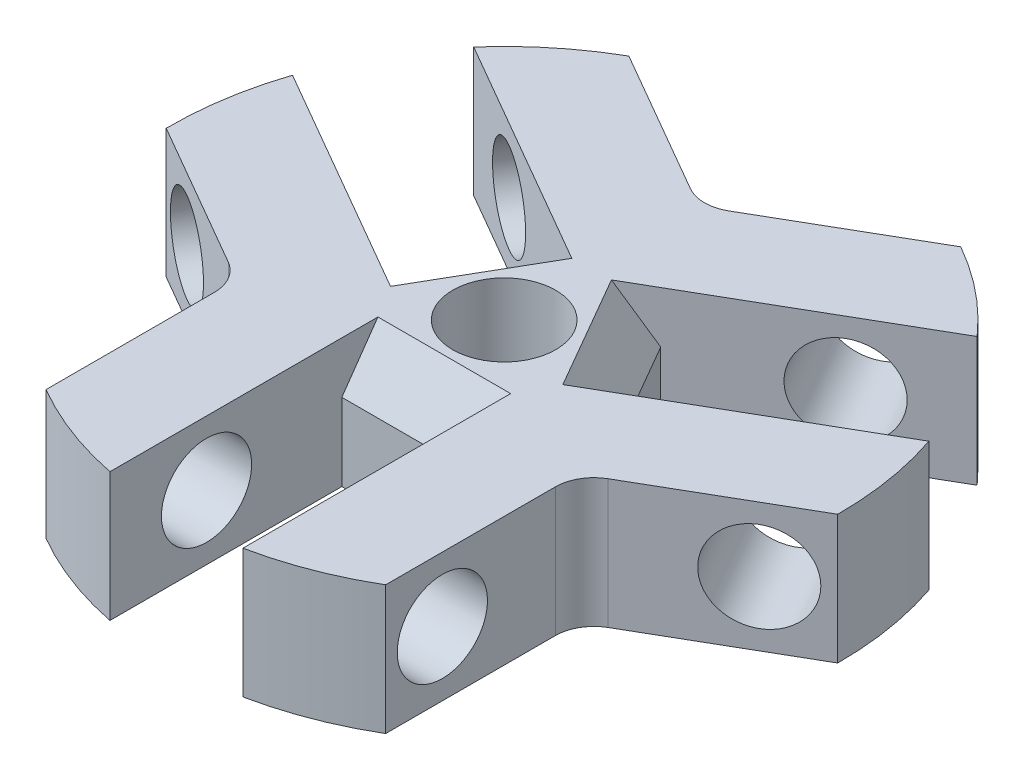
SolidWorks part; units mm, degrees
ref_plane "Plane1" through (0, 0, 0) normal (0, 0, 1) x (1, 0, 0)
ref_plane "Plane2" through (0, 0, 0) normal (0, 1, 0) x (1, 0, 0)
ref_plane "Plane3" through (0, 0, 0) normal (1, 0, 0) x (0, 0, -1)
sketch "Sketch1" plane through (0, 0, 0) normal (0, 0, 1) x (1, 0, 0)
  line L0 (0, 0) -> (0, 56.846) construction
  line L1 (-2, 0) -> (-2, 1)
  line L2 (-2, 1) -> (0, 1)
  line L3 (0, 1) -> (0, 5)
  line L4 (0, 5) -> (-13, 5)
  line L5 (-13, 5) -> (-13, 0)
  line L6 (-13, 0) -> (-2, 0)
  dimension "D1" = 2
  dimension "D2" = 13
  dimension "D3" = 1
  dimension "D4" = 5
revolve "Base-Revolve" add sketch "Sketch1" angle 360 about L0
sketch "Sketch2" plane through (0, 5, 0) normal (0, 1, 0) x (-1, 0, 0)
  line L1 (-2.6, 3.75) -> (2.55, 3.75)
  line L2 (-2.6, 3.75) -> (-2.6, 14.75)
  line L3 (-2.6, 14.75) -> (2.55, 14.75)
  line L4 (2.55, 3.75) -> (2.55, 14.75)
  dimension "D1" = 3.75
  dimension "D2" = 5.15
  dimension "D3" = 2.6
  dimension "D4" = 11
extrude "Cut-Extrude1" cut sketch "Sketch2" against normal blind 10
sketch "Sketch3" plane through (0, 5, 0) normal (0, 1, 0) x (-1, 0, 0)
  circle A0 centre (0, 0) radius 1.5
  dimension "D1" = 3
extrude "Cut-Extrude2" cut sketch "Sketch3" against normal through all
pattern_circular "CirPattern1" count 3 over 360 about axis through (0, 0, 0) along (0, 1, 0) of "Cut-Extrude1"
sketch "Sketch4" plane through (0, 5, 0) normal (0, 1, 0) x (-1, 0, 0)
  line L0 (-12.9999, 0.0578) -> (-6.6, 3.7528)
  line L1 (-6.6, 3.7528) -> (-6.6, 11.2)
  line L2 (-4.5226, 0.3334) -> (-12.3146, -4.1654) construction
  line L3 (-2.6, 12.7373) -> (-2.6, 3.75) construction
  circle A0 centre (0, 0) radius 13 construction
  arc A1 (-6.6, 11.2) -> (-12.9999, 0.0578) centre (0, 0) ccw
  dimension "D1" = 4
  dimension "D2" = 4
extrude "Cut-Extrude3" cut sketch "Sketch4" against normal blind 10
fillet "Fillet2" radius 1.5 1 edges at (6.6, 2.5, 3.7528)
pattern_circular "CirPattern2" count 3 over 360 about axis through (0, 0, 0) along (0, 1, 0) of "Fillet2", "Cut-Extrude3"
sketch "Sketch5" plane through (3.275, 0, 5.6725) normal (0.5, 0, 0.866) x (0.866, 0, -0.5)
  line L1 (11.2293, 0) -> (4.7054, 0) construction
  line L3 (0, 1) -> (0, 5) construction
  circle A0 centre (9, 2.5) radius 1.75
  dimension "D1" = 3.5
  dimension "D2" = 2.5
  dimension "D3" = 9
extrude "Cut-Extrude4" cut sketch "Sketch5" against normal through all
pattern_circular "CirPattern3" count 3 over 360 about axis through (0, 0, 0) along (0, 1, 0) of "Cut-Extrude4"
chamfer "Chamfer4" distance 2 angle 35 3 edges at (0.025, 5, 3.75) (3.2351, 5, -1.8967) (-3.2601, 5, -1.8533)
hole_wizard "M4x0.7 Tapped Hole1" positions "Sketch9" profile "Sketch8" tap size "M4x0.7" standard "ISO"
sketch "Sketch9" plane through (0, 5, 0) normal (0, 1, 0) x (-1, 0, 0)
  point P0 (0, 0)
sketch "Sketch8" plane through (0, 5, 0) normal (1, 0, 0) x (0, 0, 1)
  line L0 (0, 0) -> (0, 5)
  line L1 (0, 5) -> (1.65, 5)
  line L3 (1.65, 5) -> (1.65, 8)
  line L4 (1.65, 8) -> (2, 8)
  line L5 (2, 8) -> (2, 0)
  line L7 (2, 0) -> (0, 0)
  line L11 (0, -6.35) -> (0, 107.95) construction
  dimension "Thru Tap Drill Dia." = 3.3
  dimension "Thru Tap Drill Depth" = 5
  dimension "Thread Dia." = 4
  dimension "Thread Depth" = 8
